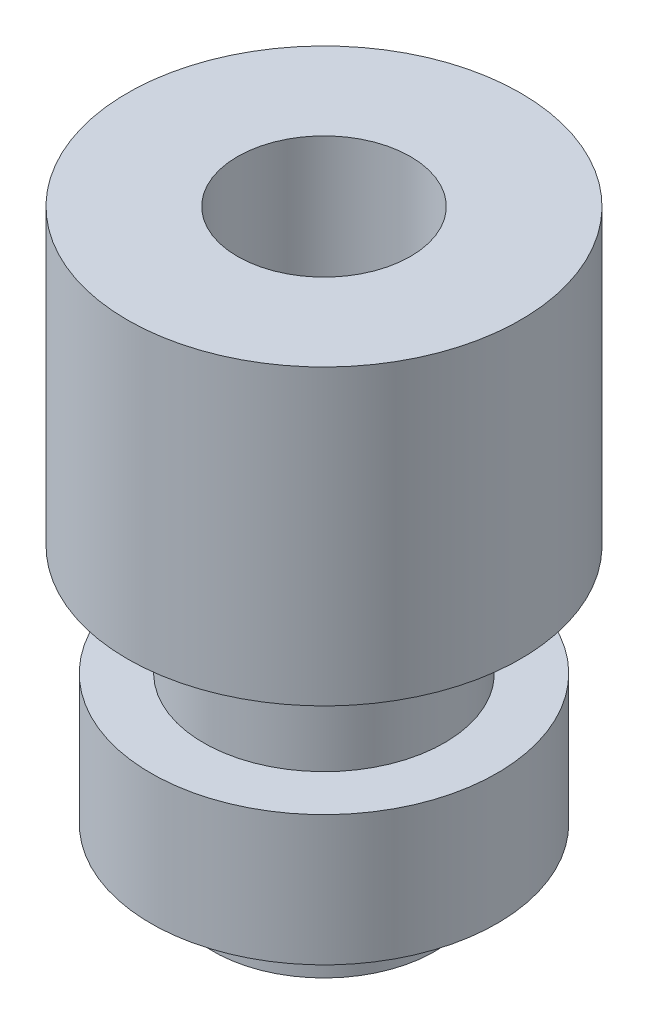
SolidWorks part; units mm, degrees
ref_plane "Front Plane" through (0, 0, 0) normal (0, 0, 1) x (1, 0, 0)
ref_plane "Top Plane" through (0, 0, 0) normal (0, 1, 0) x (1, 0, 0)
ref_plane "Right Plane" through (0, 0, 0) normal (1, 0, 0) x (0, 0, -1)
sketch "Sketch1" plane through (0, 0, 0) normal (0, 0, 1) x (1, 0, 0)
  line L0 (0, 0) -> (0, 74.4483) construction
  line L1 (-3.9687, 0) -> (-5.08, 0)
  line L2 (-5.08, 0) -> (-5.08, 2.54)
  line L3 (-5.08, 2.54) -> (-7.9375, 2.54)
  line L4 (-7.9375, 2.54) -> (-7.9375, 8.509)
  line L5 (-7.9375, 8.509) -> (-5.5245, 8.509)
  line L6 (-5.5245, 8.509) -> (-5.5245, 13.589)
  line L7 (-5.5245, 13.589) -> (-9.017, 13.589)
  line L8 (-9.017, 13.589) -> (-9.017, 27.051)
  line L9 (-9.017, 27.051) -> (-3.9688, 27.051)
  line L10 (-3.9688, 27.051) -> (-3.9687, 0)
  dimension "D1" = 10.16
  dimension "D2" = 15.875
  dimension "D3" = 11.049
  dimension "D4" = 18.034
  dimension "D5" = 2.54
  dimension "D6" = 5.969
  dimension "D7" = 5.08
  dimension "D8" = 13.462
  dimension "D9" = 7.9375
revolve "Revolve1" add sketch "Sketch1" angle 360 about L0
